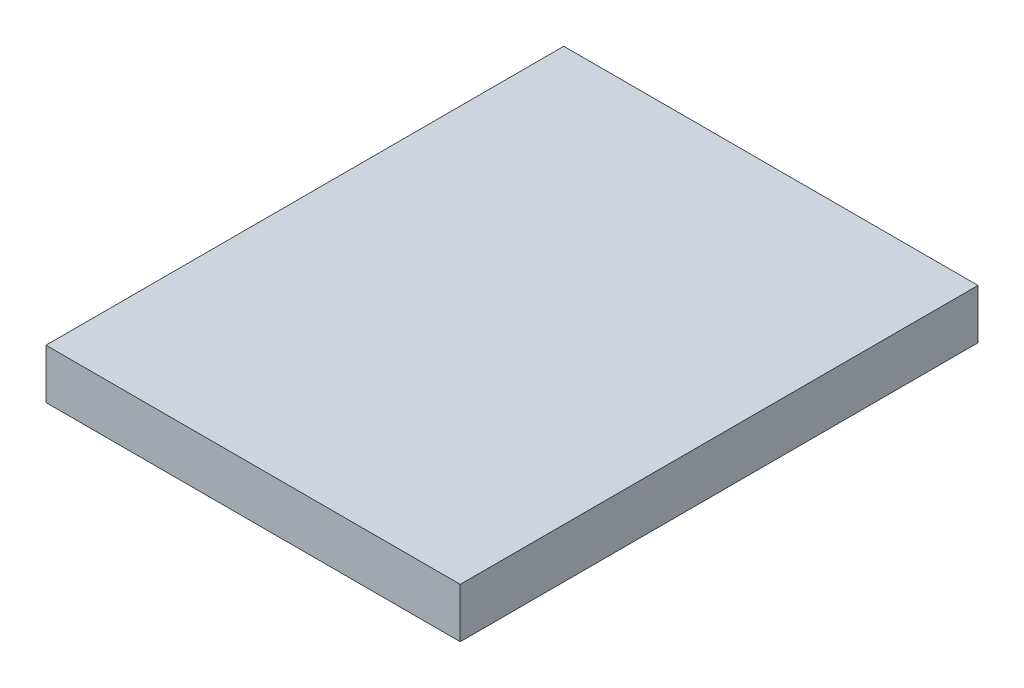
SolidWorks part; units mm, degrees
ref_plane "Face" through (0, 0, 0) normal (0, 0, 1) x (1, 0, 0)
ref_plane "Dessus" through (0, 0, 0) normal (0, 1, 0) x (1, 0, 0)
ref_plane "Droite" through (0, 0, 0) normal (1, 0, 0) x (0, 0, -1)
sketch "Esquisse1" plane through (0, 0, 0) normal (0, 0, 1) x (1, 0, 0)
  line L1 (0, 0) -> (100, 0)
  line L2 (0, 0) -> (0, -12)
  line L3 (0, -12) -> (100, -12)
  line L4 (100, 0) -> (100, -12)
  dimension "D1" = 100
  dimension "D2" = 12
extrude "Base-Extrusion" add sketch "Esquisse1" along normal blind 125
